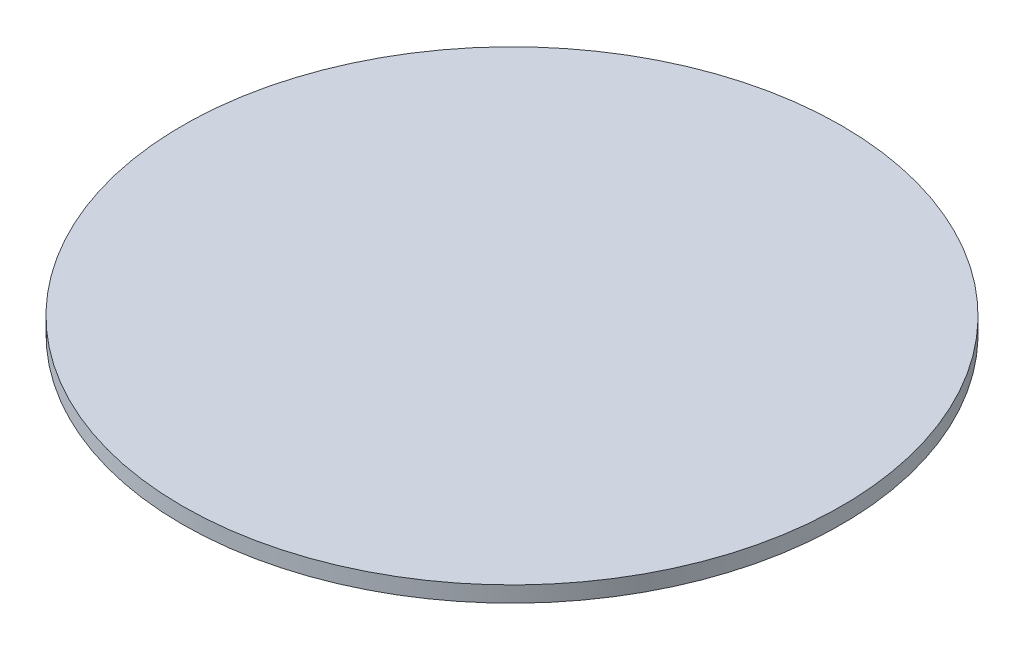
SolidWorks part; units mm, degrees
ref_plane "Frontal Plane" through (0, 0, 0) normal (0, 0, 1) x (1, 0, 0)
ref_plane "Horizontal Plane" through (0, 0, 0) normal (0, 1, 0) x (1, 0, 0)
ref_plane "Profile Plane" through (0, 0, 0) normal (1, 0, 0) x (0, 0, -1)
sketch "Sketch1" plane through (0, 0, 0) normal (0, 1, 0) x (1, 0, 0)
  circle A0 centre (0, 0) radius 25.8953
  dimension "D1" = 51.7906
extrude "Boss-Extrude1" add sketch "Sketch1" along normal blind 1.2446
